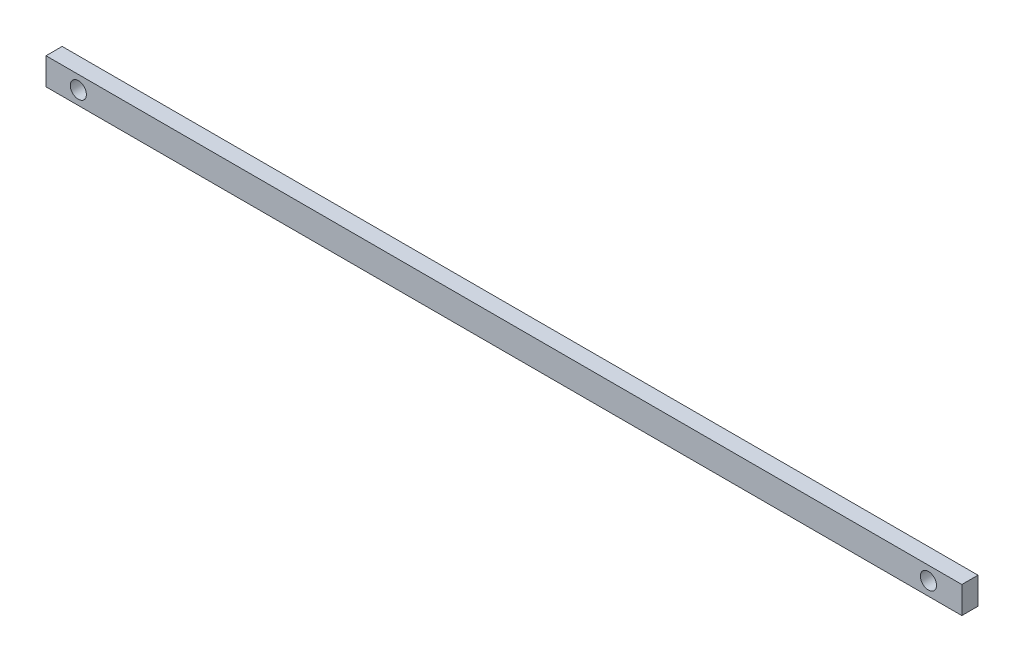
SolidWorks part; units mm, degrees
ref_plane "Plan de face" through (0, 0, 0) normal (0, 0, 1) x (1, 0, 0)
ref_plane "Plan de dessus" through (0, 0, 0) normal (0, 1, 0) x (1, 0, 0)
ref_plane "Plan de droite" through (0, 0, 0) normal (1, 0, 0) x (0, 0, -1)
sketch "Esquisse1" plane through (0, 0, 0) normal (0, 0, 1) x (1, 0, 0)
  line L1 (0, 0) -> (850, 0)
  line L2 (0, 0) -> (0, 25)
  line L3 (0, 25) -> (850, 25)
  line L4 (850, 0) -> (850, 25)
  circle A0 centre (30, 12.5) radius 7.5
  circle A1 centre (819, 12.5) radius 7.5
  dimension "D3" = 15
  dimension "D4" = 12.5
  dimension "D5" = 30
  dimension "D6" = 15
  dimension "D7" = 12.5
  dimension "D8" = 789
  dimension "D1" = 850
  dimension "D2" = 25
extrude "Boss.-Extru.1" add sketch "Esquisse1" along normal blind 15
